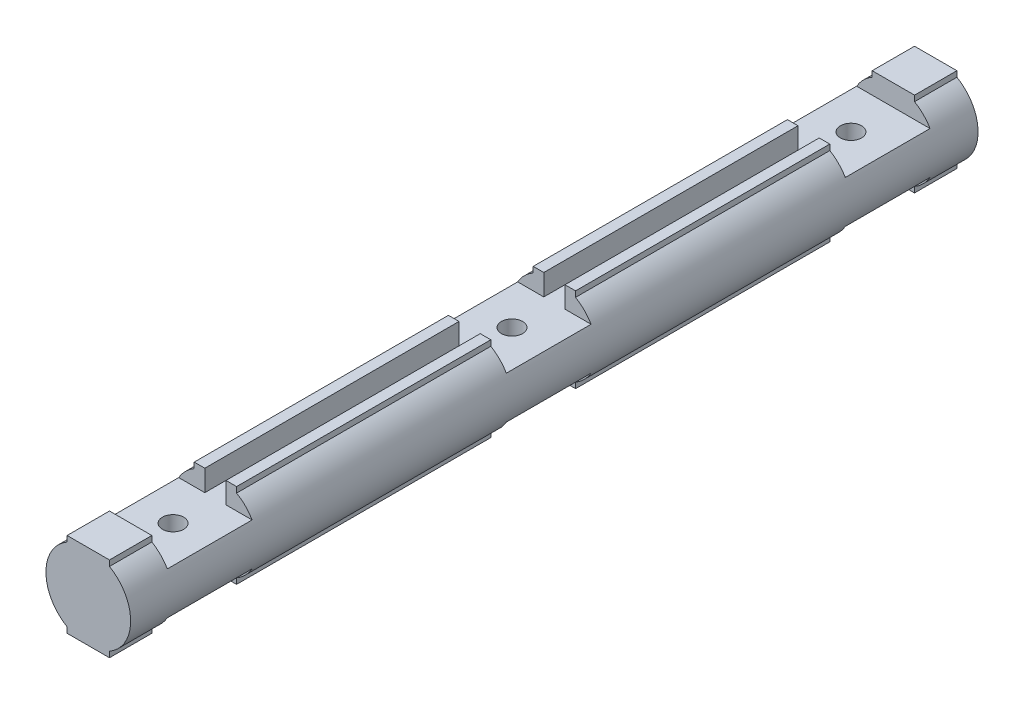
SolidWorks part; units mm, degrees
ref_plane "Front Plane" through (0, 0, 0) normal (0, 0, 1) x (1, 0, 0)
ref_plane "Top Plane" through (0, 0, 0) normal (0, 1, 0) x (1, 0, 0)
ref_plane "Right Plane" through (0, 0, 0) normal (1, 0, 0) x (0, 0, -1)
sketch "Sketch1" plane through (0, 0, 0) normal (0, 0, 1) x (1, 0, 0)
  circle A0 centre (0, 0) radius 10
  dimension "D1" = 20
extrude "Boss-Extrude1" add sketch "Sketch1" along normal mid plane 200
sketch "Sketch2" plane through (0, 0, 100) normal (0, 0, 1) x (1, 0, 0)
  line L1 (5, -10) -> (-5, -10)
  line L2 (5, -10) -> (5, 10)
  line L3 (5, 10) -> (-5, 10)
  line L4 (-5, -10) -> (-5, 10)
  line L5 (5, -10) -> (-5, 10) construction
  line L6 (5, 10) -> (-5, -10) construction
  circle A0 centre (0, 0) radius 10 construction
  point P0 (0, 0)
  dimension "D2" = 10
extrude "Boss-Extrude2" add sketch "Sketch2" against normal up to surface (200 mm away)
ref_plane "Plane1" through (0, 0, -80) normal (0, 0, -1) x (-1, 0, 0)
sketch "Sketch3" plane through (0, 0, -80) normal (0, 0, 1) x (1, 0, 0)
  line L1 (8.6603, 5) -> (-8.6603, 5)
  line L2 (8.6603, 5) -> (8.6603, 10)
  line L3 (8.6603, 10) -> (-8.6603, 10)
  line L4 (-8.6603, 5) -> (-8.6603, 10)
  line L5 (8.6603, 5) -> (-8.6603, 10) construction
  line L6 (8.6603, 10) -> (-8.6603, 5) construction
  circle A0 centre (0, 0) radius 10 construction
  point P0 (0, 7.5)
  dimension "D1" = 5
extrude "Cut-Extrude1" cut sketch "Sketch3" against normal mid plane 20
sketch "Sketch4" plane through (0, 5, 0) normal (0, 1, 0) x (1, 0, 0)
  line L0 (-8.6603, 90) -> (8.6603, 70) construction
  circle A0 centre (0, 80) radius 2.5
  dimension "D1" = 5
extrude "Cut-Extrude3" cut sketch "Sketch4" against normal through all
sketch "Sketch5" plane through (0, 10, 0) normal (0, 1, 0) x (1, 0, 0)
  line L0 (-8.6603, 70) -> (8.6603, 70) construction
  line L1 (2.5, -70) -> (-2.5, -70)
  line L2 (2.5, -70) -> (2.5, 70)
  line L3 (2.5, 70) -> (-2.5, 70)
  line L4 (-2.5, -70) -> (-2.5, 70)
  line L5 (2.5, -70) -> (-2.5, 70) construction
  line L6 (2.5, 70) -> (-2.5, -70) construction
  point P0 (0, 0)
  dimension "D1" = 5
extrude "Cut-Extrude2" cut sketch "Sketch5" against normal up to surface (5 mm away)
pattern_linear "LPattern1" count 3 spacing 80 along (0, 0, 1) of "Cut-Extrude1", "Cut-Extrude3"
mirror "Mirror1" about plane through (0, 0, 0) normal (0, 1, 0) of "Cut-Extrude1", "Cut-Extrude2", "LPattern1"
